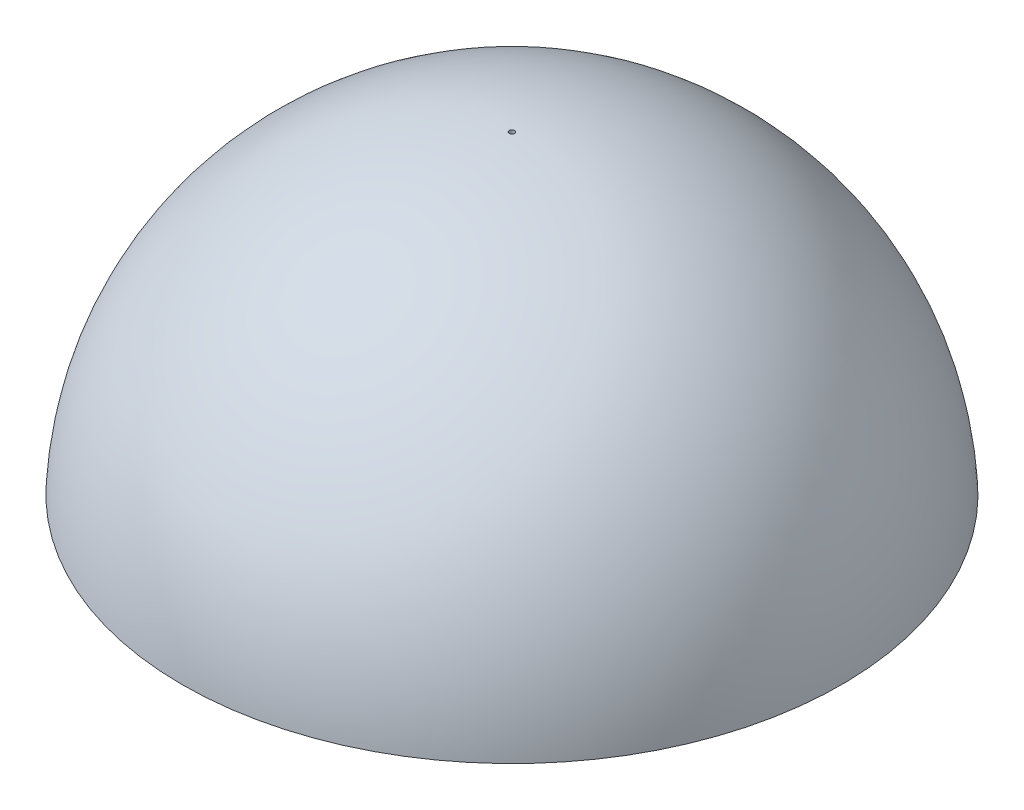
SolidWorks part; units mm, degrees
ref_plane "Front Plane" through (0, 0, 0) normal (0, 0, 1) x (1, 0, 0)
ref_plane "Top Plane" through (0, 0, 0) normal (0, 1, 0) x (1, 0, 0)
ref_plane "Right Plane" through (0, 0, 0) normal (1, 0, 0) x (0, 0, -1)
sketch "Sketch1" plane through (0, 0, 0) normal (0, 1, 0) x (1, 0, 0)
  line L0 (0, 62) -> (0, 60)
  line L1 (0, -60) -> (0, -62)
  arc A0 (0, -62) -> (0, 62) centre (0, 0) ccw
  arc A1 (0, -60) -> (0, 60) centre (0, 0) ccw
  dimension "D1" = 124
  dimension "D2" = 2
revolve "Revolve1" add sketch "Sketch1" angle 180 about L0
ref_plane "Plane1" through (0, 0, 0) normal (0, 1, 0) x (1, 0, 0)
sketch "Sketch3" plane through (0, 0, 0) normal (0, 1, 0) x (1, 0, 0)
  circle A0 centre (0, 0) radius 60
  dimension "D1" = 120
extrude "Boss-Extrude1" add sketch "Sketch3" along normal blind 2 separate body
sketch "Sketch4" plane through (0, 0, 0) normal (0, 1, 0) x (1, 0, 0)
  circle A0 centre (0, 0) radius 56
extrude "Cut-Extrude4" cut sketch "Sketch4" along normal blind 2
sketch "Sketch5" plane through (0, 0, 0) normal (0, 1, 0) x (1, 0, 0)
  circle A0 centre (0, 0) radius 71.4636
extrude "Cut-Extrude5" cut sketch "Sketch5" along normal blind 3
sketch "Sketch6" plane through (0, 0, 0) normal (0, 1, 0) x (1, 0, 0)
  circle A0 centre (0, 0) radius 0.5
  dimension "D1" = 1
extrude "Cut-Extrude6" cut sketch "Sketch6" along normal through all
